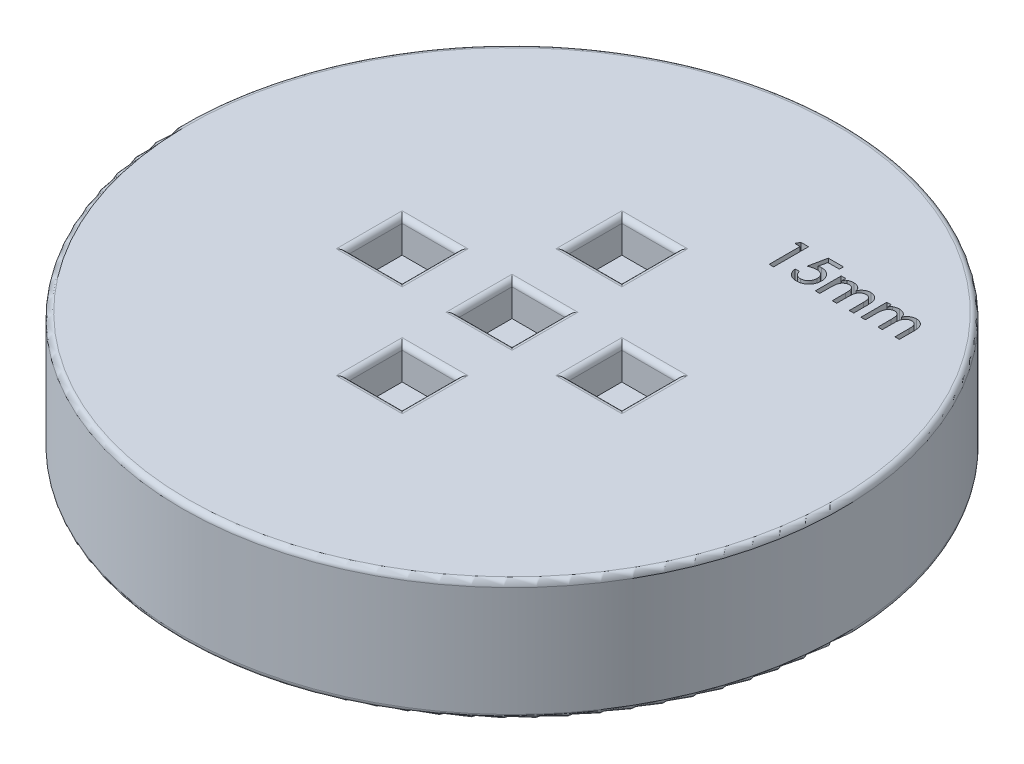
SolidWorks part; units mm, degrees
ref_plane "Front Plane" through (0, 0, 0) normal (0, 0, 1) x (1, 0, 0)
ref_plane "Top Plane" through (0, 0, 0) normal (0, 1, 0) x (1, 0, 0)
ref_plane "Right Plane" through (0, 0, 0) normal (1, 0, 0) x (0, 0, -1)
sketch "Sketch1" plane through (0, 0, 0) normal (0, 1, 0) x (1, 0, 0)
  circle A0 centre (0, 0) radius 30
extrude "Boss-Extrude1" add sketch "Sketch1" along normal blind 11
sketch "Sketch2" plane through (0, 11, 0) normal (0, 1, 0) x (1, 0, 0)
  line L0 (0, 0) -> (0, -10) construction
  line L1 (0, 0) -> (10, 0) construction
  line L2 (0, 0) -> (-10, 0) construction
  line L3 (0, 0) -> (0, 10) construction
  line L5 (-2.5, -7.5) -> (2.5, -7.5)
  line L6 (-2.5, -7.5) -> (-2.5, -12.5)
  line L7 (-2.5, -12.5) -> (2.5, -12.5)
  line L8 (2.5, -7.5) -> (2.5, -12.5)
  line L9 (-2.5, -7.5) -> (2.5, -12.5) construction
  line L10 (-2.5, -12.5) -> (2.5, -7.5) construction
  line L11 (-7.5, -2.5) -> (-12.5, -2.5)
  line L12 (-7.5, -2.5) -> (-7.5, 2.5)
  line L13 (-7.5, 2.5) -> (-12.5, 2.5)
  line L14 (-12.5, -2.5) -> (-12.5, 2.5)
  line L15 (-7.5, -2.5) -> (-12.5, 2.5) construction
  line L16 (-7.5, 2.5) -> (-12.5, -2.5) construction
  line L17 (2.5, -2.5) -> (-2.5, -2.5)
  line L18 (2.5, -2.5) -> (2.5, 2.5)
  line L19 (2.5, 2.5) -> (-2.5, 2.5)
  line L20 (-2.5, -2.5) -> (-2.5, 2.5)
  line L21 (2.5, -2.5) -> (-2.5, 2.5) construction
  line L22 (2.5, 2.5) -> (-2.5, -2.5) construction
  line L23 (-2.5, 12.5) -> (2.5, 12.5)
  line L24 (-2.5, 12.5) -> (-2.5, 7.5)
  line L25 (-2.5, 7.5) -> (2.5, 7.5)
  line L26 (2.5, 12.5) -> (2.5, 7.5)
  line L27 (-2.5, 12.5) -> (2.5, 7.5) construction
  line L28 (-2.5, 7.5) -> (2.5, 12.5) construction
  line L29 (12.5, -2.5) -> (7.5, -2.5)
  line L30 (12.5, -2.5) -> (12.5, 2.5)
  line L31 (12.5, 2.5) -> (7.5, 2.5)
  line L32 (7.5, -2.5) -> (7.5, 2.5)
  line L33 (12.5, -2.5) -> (7.5, 2.5) construction
  line L34 (12.5, 2.5) -> (7.5, -2.5) construction
  dimension "D1" = 5
  dimension "D2" = 10
  dimension "D3" = 5
  dimension "D4" = 5
  dimension "D5" = 5
  dimension "D6" = 5
  dimension "D7" = 5
  dimension "D8" = 5
extrude "Cut-Extrude1" cut sketch "Sketch2" against normal blind 3
fillet "Fillet1" radius 0.5 6 edges at (2.5, 11, 0) (0, 11, 2.5) (-12.5, 11, 0) (-10, 11, 2.5) (-7.5, 11, 0) (-10, 11, -2.5)
sketch "Sketch3" plane through (0, 11, 0) normal (0, 1, 0) x (1, 0, 0)
sketch "Sketch4" plane through (0, 0, 0) normal (0, -1, 0) x (-1, 0, 0)
  line L0 (0, 0) -> (-10, 0) construction
  line L1 (0, 0) -> (0, -10) construction
  line L2 (0, 0) -> (0, 10) construction
  line L3 (0, 0) -> (10, 0) construction
  line L5 (-2.5, 2.5) -> (2.5, 2.5)
  line L6 (-2.5, 2.5) -> (-2.5, -2.5)
  line L7 (-2.5, -2.5) -> (2.5, -2.5)
  line L8 (2.5, 2.5) -> (2.5, -2.5)
  line L9 (-2.5, 2.5) -> (2.5, -2.5) construction
  line L10 (-2.5, -2.5) -> (2.5, 2.5) construction
  line L11 (-2.5, -7.5) -> (2.5, -7.5)
  line L12 (-2.5, -7.5) -> (-2.5, -12.5)
  line L13 (-2.5, -12.5) -> (2.5, -12.5)
  line L14 (2.5, -7.5) -> (2.5, -12.5)
  line L15 (-2.5, -7.5) -> (2.5, -12.5) construction
  line L16 (-2.5, -12.5) -> (2.5, -7.5) construction
  line L17 (7.5, 2.5) -> (12.5, 2.5)
  line L18 (7.5, 2.5) -> (7.5, -2.5)
  line L19 (7.5, -2.5) -> (12.5, -2.5)
  line L20 (12.5, 2.5) -> (12.5, -2.5)
  line L21 (7.5, 2.5) -> (12.5, -2.5) construction
  line L22 (7.5, -2.5) -> (12.5, 2.5) construction
  line L23 (-12.5, 2.5) -> (-7.5, 2.5)
  line L24 (-12.5, 2.5) -> (-12.5, -2.5)
  line L25 (-12.5, -2.5) -> (-7.5, -2.5)
  line L26 (-7.5, 2.5) -> (-7.5, -2.5)
  line L27 (-12.5, 2.5) -> (-7.5, -2.5) construction
  line L28 (-12.5, -2.5) -> (-7.5, 2.5) construction
  line L29 (2.5, 7.5) -> (-2.5, 7.5)
  line L30 (2.5, 7.5) -> (2.5, 12.5)
  line L31 (2.5, 12.5) -> (-2.5, 12.5)
  line L32 (-2.5, 7.5) -> (-2.5, 12.5)
  line L33 (2.5, 7.5) -> (-2.5, 12.5) construction
  line L34 (2.5, 12.5) -> (-2.5, 7.5) construction
  dimension "D1" = 5
  dimension "D2" = 5
  dimension "D3" = 5
  dimension "D4" = 5
  dimension "D5" = 5
  dimension "D6" = 5
extrude "Cut-Extrude2" cut sketch "Sketch4" against normal blind 3
fillet "Fillet2" radius 0.5 21 edges at (0, 0, 30) (2.5, 0, 0) (0, 0, 2.5) (-2.5, 0, 0) (0, 0, -2.5) (2.5, 0, 10) (0, 0, 12.5) (-2.5, 0, 10) (0, 0, 7.5) (-7.5, 0, 0) (-10, 0, 2.5) (-12.5, 0, 0) (-10, 0, -2.5) (12.5, 0, 0) (10, 0, 2.5) (7.5, 0, 0) (10, 0, -2.5) (-2.5, 0, -10) (0, 0, -12.5) (2.5, 0, -10) (0, 0, -7.5)
fillet "Fillet3" radius 0.5 15 edges at (0, 11, 30) (0, 11, 7.5) (-2.5, 11, 10) (0, 11, 12.5) (2.5, 11, 10) (-2.5, 11, 0.25) (0.25, 11, -2.5) (0, 11, -12.5) (-2.5, 11, -10) (0, 11, -7.5) (2.5, 11, -10) (10, 11, 2.5) (12.5, 11, 0) (10, 11, -2.5) (7.5, 11, 0)
sketch "Sketch5" plane through (0, 11, 0) normal (0, 1, 0) x (1, 0, 0)
  text T0 "<b>15mm</b>"
extrude "Cut-Extrude3" cut sketch "Sketch5" against normal blind 2
